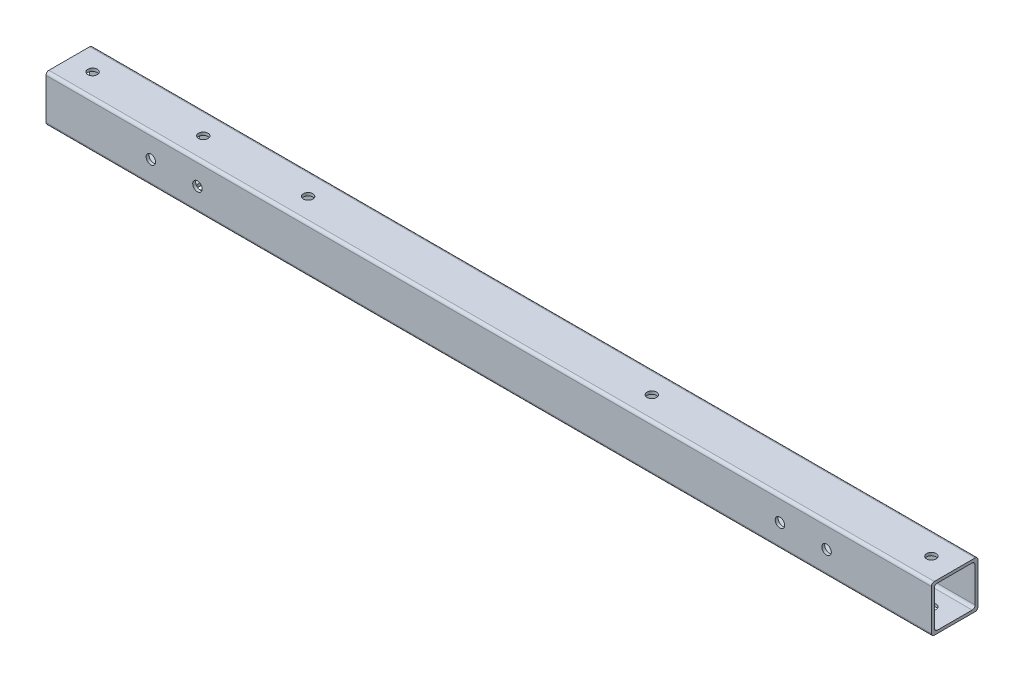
SolidWorks part; units mm, degrees
ref_plane "Front Plane" through (0, 0, 0) normal (0, 0, 1) x (1, 0, 0)
ref_plane "Top Plane" through (0, 0, 0) normal (0, 1, 0) x (1, 0, 0)
ref_plane "Right Plane" through (0, 0, 0) normal (1, 0, 0) x (0, 0, -1)
sketch "Sketch1" plane through (0, 0, 0) normal (0, 1, 0) x (1, 0, 0)
  line L1 (0, 0) -> (-1930.4, 0)
  line L2 (0, 0) -> (0, -101.6)
  line L3 (0, -101.6) -> (-1930.4, -101.6)
  line L4 (-1930.4, 0) -> (-1930.4, -101.6)
  dimension "D1" = 1930.4
  dimension "D2" = 101.6
extrude "Extrude1" add sketch "Sketch1" along normal blind 101.6
sketch "Sketch2" plane through (-1930.4, 0, 0) normal (-1, 0, 0) x (0, 0, 1)
  line L0 (0, 101.6) -> (101.6, 101.6) construction
  line L1 (6.35, 95.25) -> (95.25, 95.25)
  line L2 (6.35, 95.25) -> (6.35, 6.35)
  line L3 (6.35, 6.35) -> (95.25, 6.35)
  line L4 (95.25, 95.25) -> (95.25, 6.35)
  line L5 (0, 0) -> (101.6, 0) construction
  line L6 (101.6, 101.6) -> (101.6, 0) construction
  line L7 (0, 101.6) -> (0, 0) construction
  dimension "D1" = 6.35
  dimension "D2" = 6.35
  dimension "D3" = 6.35
  dimension "D4" = 6.35
extrude "Cut-Extrude1" cut sketch "Sketch2" against normal up to next
sketch "Sketch3" plane through (0, 101.6, 0) normal (0, 1, 0) x (1, 0, 0)
  line L0 (-1930.4, 0) -> (-1930.4, -101.6) construction
  line L1 (0, 0) -> (-1930.4, 0) construction
  circle A0 centre (-1879.6, -50.8) radius 10.3188
  dimension "D1" = 20.6375
  dimension "D2" = 50.8
  dimension "D3" = 50.8
extrude "Cut-Extrude2" cut sketch "Sketch3" against normal through all
fillet "Fillet1" radius 6.35 8 edges at (-965.2, 6.35, 95.25) (-965.2, 0, 101.6) (-965.2, 101.6, 101.6) (-965.2, 95.25, 95.25) (-965.2, 95.25, 6.35) (-965.2, 101.6, 0) (-965.2, 6.35, 6.35) (-965.2, 0, 0)
sketch "Sketch5" plane through (0, 0, 0) normal (0, 0, -1) x (-1, 0, 0)
  line L0 (1930.4, 95.25) -> (1930.4, 6.35) construction
  line L1 (1930.4, 95.25) -> (0, 95.25) construction
  circle A0 centre (1701.8, 50.8) radius 10.3188
  circle A1 centre (1600.2, 50.8) radius 10.3188
  dimension "D1" = 20.6375
  dimension "D2" = 228.6
  dimension "D3" = 330.2
  dimension "D4" = 44.45
extrude "Cut-Extrude4" cut sketch "Sketch5" against normal blind 101.6
ref_plane "Plane1" through (-965.2, 0, 0) normal (1, 0, 0) x (0, 0, -1)
mirror "Mirror1" about plane through (-965.2, 0, 0) normal (1, 0, 0) of "Cut-Extrude4", "Cut-Extrude2"
sketch "Sketch6" plane through (0, 101.6, 0) normal (0, 1, 0) x (1, 0, 0)
  line L0 (0, -95.25) -> (0, -6.35) construction
  line L1 (0, -6.35) -> (-1930.4, -6.35) construction
  circle A0 centre (-660.4, -50.8) radius 10.3188
  dimension "D1" = 20.6375
  dimension "D2" = 660.4
  dimension "D3" = 44.45
extrude "Cut-Extrude5" cut sketch "Sketch6" against normal blind 101.6
sketch "Sketch8" plane through (0, 101.6, 0) normal (0, 1, 0) x (1, 0, 0)
  line L0 (0, -95.25) -> (0, -6.35) construction
  line L1 (0, -6.35) -> (-1930.4, -6.35) construction
  circle A0 centre (-1409.7, -50.8) radius 10.3188
  dimension "D1" = 20.6375
  dimension "D2" = 1409.7
  dimension "D3" = 44.45
extrude "Cut-Extrude7" cut sketch "Sketch8" against normal blind 101.6
sketch "Sketch9" plane through (0, 101.6, 0) normal (0, 1, 0) x (1, 0, 0)
  line L0 (0, -95.25) -> (0, -6.35) construction
  line L1 (0, -6.35) -> (-1930.4, -6.35) construction
  circle A0 centre (-1638.3, -50.8) radius 10.3188
  dimension "D1" = 20.6375
  dimension "D2" = 1638.3
  dimension "D3" = 44.45
extrude "Cut-Extrude8" cut sketch "Sketch9" against normal through all
